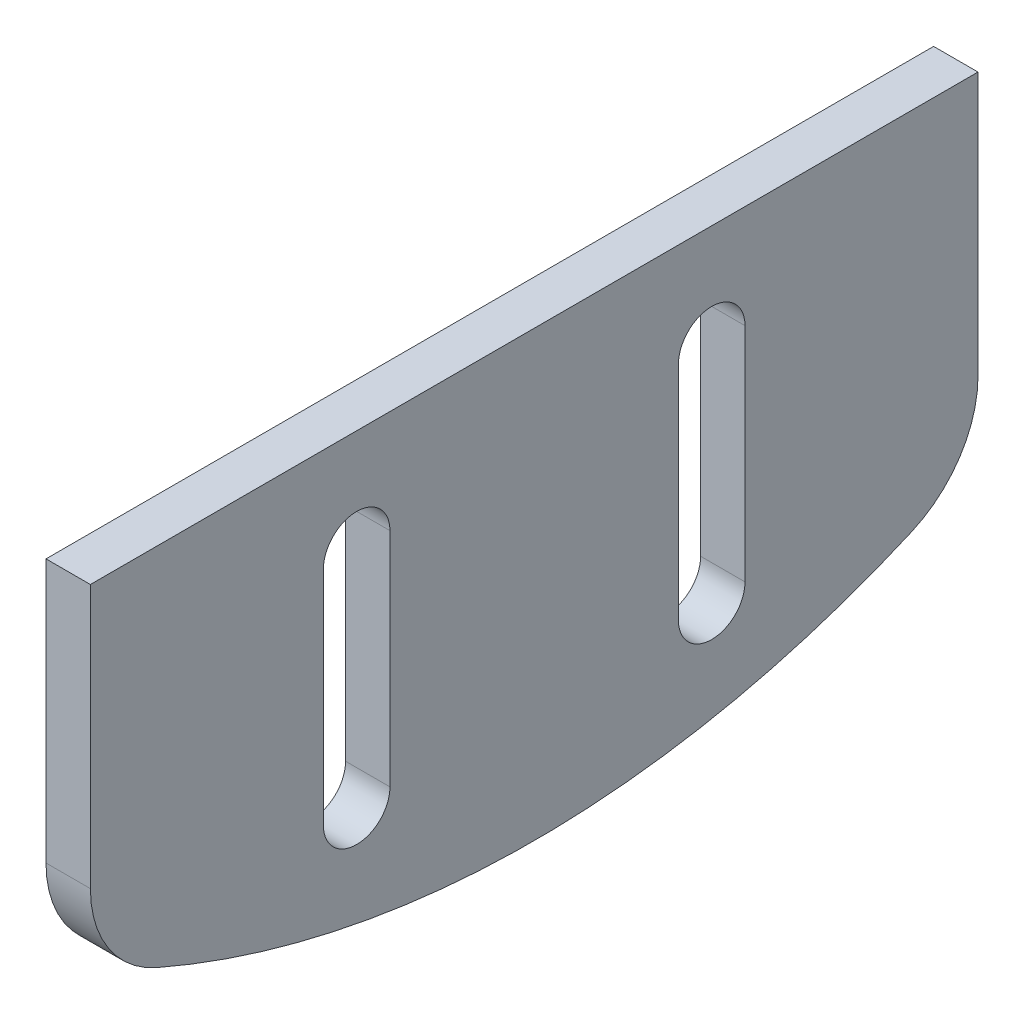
SolidWorks part; units mm, degrees
ref_plane "前视基准面" through (0, 0, 0) normal (0, 0, 1) x (1, 0, 0)
ref_plane "上视基准面" through (0, 0, 0) normal (0, 1, 0) x (1, 0, 0)
ref_plane "右视基准面" through (0, 0, 0) normal (1, 0, 0) x (0, 0, -1)
sketch "草图1" plane through (0, 0, 0) normal (1, 0, 0) x (0, 0, -1)
  line L0 (0, 0) -> (0, 35.1042) construction
  line L3 (-20, 5) -> (-20, 20)
  line L4 (-20, 20) -> (20, 20)
  line L5 (20, 5) -> (20, 20)
  arc A0 (-20, 5) -> (20, 5) centre (0, 42.5) ccw
  point P3 (0, 13.8056)
  point P9 (0, 20)
  point P10 (0, 0)
  point P11 (0, 0)
  dimension "D1" = 20
  dimension "D2" = 40
  dimension "D3" = 15
extrude "凸台-拉伸1" add sketch "草图1" along normal blind 2
sketch "草图2" plane through (2, 0, 0) normal (1, 0, 0) x (0, 0, -1)
  line L0 (0, 0) -> (0, 24.7361) construction
  line L1 (-8, 5.3516) -> (-8, 15.3516) construction
  line L2 (-9.5, 5.3516) -> (-9.5, 15.3516)
  line L3 (-6.5, 5.3516) -> (-6.5, 15.3516)
  line L4 (8, 5.3516) -> (8, 15.3516) construction
  line L5 (9.5, 5.3516) -> (9.5, 15.3516)
  line L6 (6.5, 5.3516) -> (6.5, 15.3516)
  arc A0 (-9.5, 5.3516) -> (-6.5, 5.3516) centre (-8, 5.3516) ccw
  arc A1 (-6.5, 15.3516) -> (-9.5, 15.3516) centre (-8, 15.3516) ccw
  arc A3 (-20, 5) -> (20, 5) centre (0, 42.5) ccw construction
  arc A4 (9.5, 5.3516) -> (6.5, 5.3516) centre (8, 5.3516) cw
  arc A5 (6.5, 15.3516) -> (9.5, 15.3516) centre (8, 15.3516) cw
  point P5 (-8, 10.3516)
  point P15 (8, 10.3516)
  dimension "D3" = 3
  dimension "D1" = 3
  dimension "D2" = 8
  dimension "D4" = 10
extrude "切除-拉伸1" cut sketch "草图2" against normal blind 2
fillet "圆角1" radius 5 2 edges at (1, 5, 20) (1, 5, -20)
